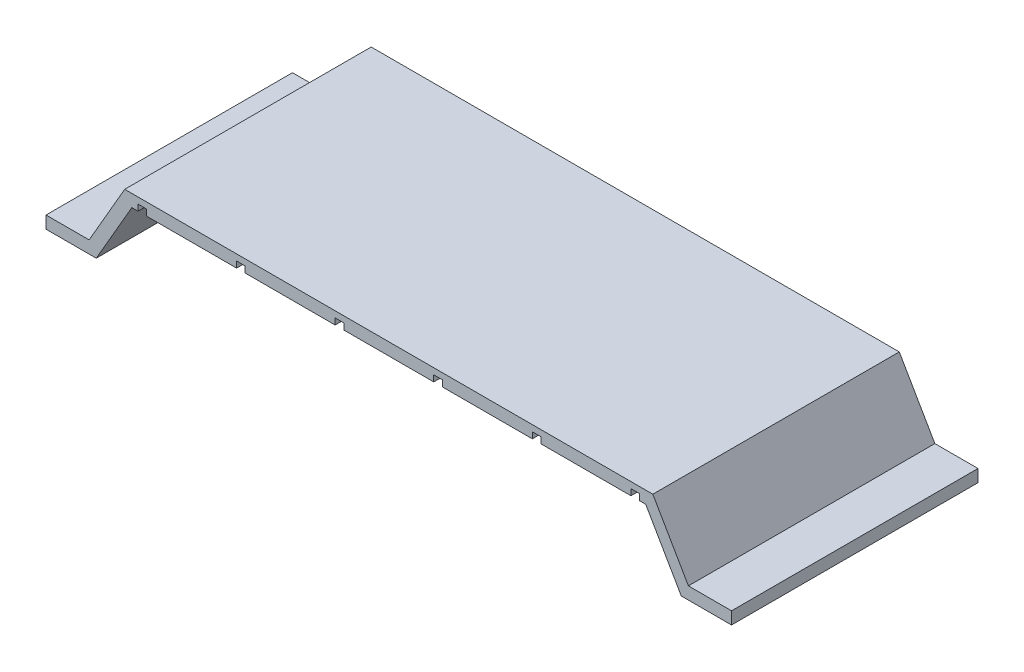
SolidWorks part; units mm, degrees
ref_plane "Front Plane" through (0, 0, 0) normal (0, 0, 1) x (1, 0, 0)
ref_plane "Top Plane" through (0, 0, 0) normal (0, 1, 0) x (1, 0, 0)
ref_plane "Right Plane" through (0, 0, 0) normal (1, 0, 0) x (0, 0, -1)
sketch "Sketch1" plane through (0, 0, 0) normal (0, 0, 1) x (1, 0, 0)
  line L0 (9.271, 0) -> (-9.271, 0)
  line L1 (-52.959, 0) -> (-60.2913, -12.7)
  line L2 (-60.2913, -12.7) -> (-70.6478, -12.7)
  line L3 (-70.6478, -12.7) -> (-70.6478, -10.16)
  line L4 (-70.6478, -10.16) -> (-61.7578, -10.16)
  line L5 (-61.7578, -10.16) -> (-54.4255, 2.54)
  line L6 (-54.4255, 2.54) -> (54.4255, 2.54)
  line L7 (0, 0) -> (0, -11.5761) construction
  line L8 (-10.16, 1.27) -> (-10.16, -3.0486) construction
  line L9 (-31.369, 0) -> (-49.911, 0)
  line L10 (-51.689, 0) -> (-51.689, 1.27)
  line L11 (-51.689, 1.27) -> (-49.911, 1.27)
  line L12 (-49.911, 0) -> (-49.911, 1.27)
  line L13 (-11.049, 0) -> (-29.591, 0)
  line L14 (-31.369, 0) -> (-31.369, 1.27)
  line L15 (-31.369, 1.27) -> (-29.591, 1.27)
  line L16 (-29.591, 0) -> (-29.591, 1.27)
  line L17 (51.689, 0) -> (52.959, 0)
  line L18 (-11.049, 0) -> (-11.049, 1.27)
  line L19 (-11.049, 1.27) -> (-9.271, 1.27)
  line L20 (-9.271, 0) -> (-9.271, 1.27)
  line L21 (-51.689, 0) -> (-52.959, 0)
  line L22 (9.271, 0) -> (9.271, 1.27)
  line L23 (11.049, 1.27) -> (9.271, 1.27)
  line L24 (11.049, 0) -> (11.049, 1.27)
  line L25 (29.591, 0) -> (29.591, 1.27)
  line L26 (31.369, 1.27) -> (29.591, 1.27)
  line L27 (31.369, 0) -> (31.369, 1.27)
  line L28 (11.049, 0) -> (29.591, 0)
  line L29 (49.911, 0) -> (49.911, 1.27)
  line L30 (51.689, 1.27) -> (49.911, 1.27)
  line L31 (51.689, 0) -> (51.689, 1.27)
  line L32 (31.369, 0) -> (49.911, 0)
  line L33 (61.7578, -10.16) -> (54.4255, 2.54)
  line L34 (70.6478, -10.16) -> (61.7578, -10.16)
  line L35 (70.6478, -12.7) -> (70.6478, -10.16)
  line L36 (60.2913, -12.7) -> (70.6478, -12.7)
  line L37 (52.959, 0) -> (60.2913, -12.7)
  point P38 (0, 2.54)
  dimension "D1" = 2.54
  dimension "D2" = 2.54
  dimension "D3" = 2.54
  dimension "D4" = 1.27
  dimension "D5" = 120
  dimension "D6" = 8.89
  dimension "D7" = 12.7
  dimension "D8" = 1.778
  dimension "D9" = 1.27
  dimension "D10" = 10.16
  dimension "D11" = 20.32
  dimension "D12" = 20.32
extrude "Boss-Extrude1" add sketch "Sketch1" along normal mid plane 50.8
